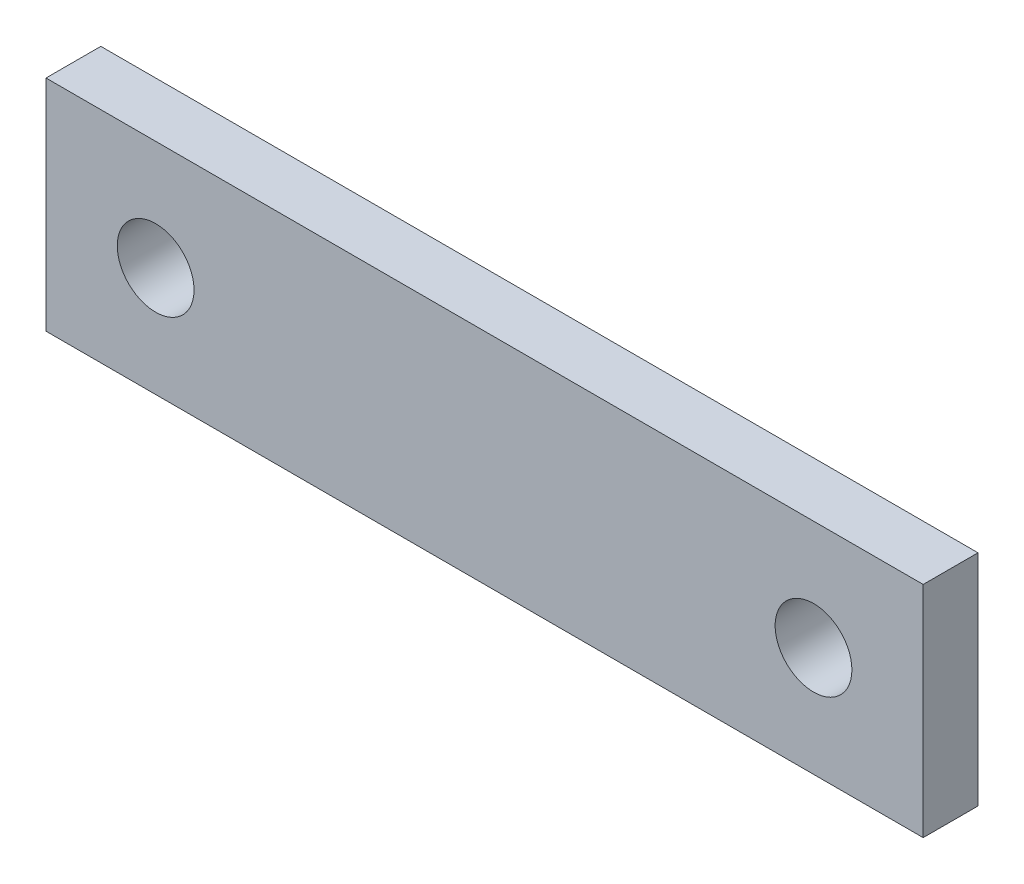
SolidWorks part; units mm, degrees
ref_plane "Plan de face" through (0, 0, 0) normal (0, 0, 1) x (1, 0, 0)
ref_plane "Plan de dessus" through (0, 0, 0) normal (0, 1, 0) x (1, 0, 0)
ref_plane "Plan de droite" through (0, 0, 0) normal (1, 0, 0) x (0, 0, -1)
sketch "Esquisse1" plane through (0, 0, 0) normal (1, 0, 0) x (0, 0, -1)
  line L1 (0, -20) -> (10, -20)
  line L2 (0, -20) -> (0, 20)
  line L3 (0, 20) -> (10, 20)
  line L4 (10, -20) -> (10, 20)
  point P4 (0, 0)
  dimension "D1" = 10
  dimension "D2" = 40
extrude "Extrusion1" add sketch "Esquisse1" along normal mid plane 160
hole_wizard "Dégagement M131" positions "Esquisse3" profile "Esquisse2" hole size "M13" standard "ISO"
sketch "Esquisse3" plane through (0, 0, 0) normal (0, 0, 1) x (1, 0, 0)
  line L0 (-80, 20) -> (-80, -20) construction
  point P0 (60, 0)
  point P1 (-60, 0)
  dimension "D1" = 120
  dimension "D2" = 20
sketch "Esquisse2" plane through (60, 0, 0) normal (1, 0, 0) x (0, -1, 0)
  line L0 (0, 0) -> (0, 10)
  line L1 (0, 10) -> (7, 10)
  line L2 (7, 10) -> (7, 0)
  line L5 (7, 0) -> (0, 0)
  line L11 (0, -6.35) -> (0, 107.95) construction
  dimension "Diamètre du perçage jusqu'au prochain" = 14
  dimension "Profondeur du perçage jusqu'au prochain" = 10
